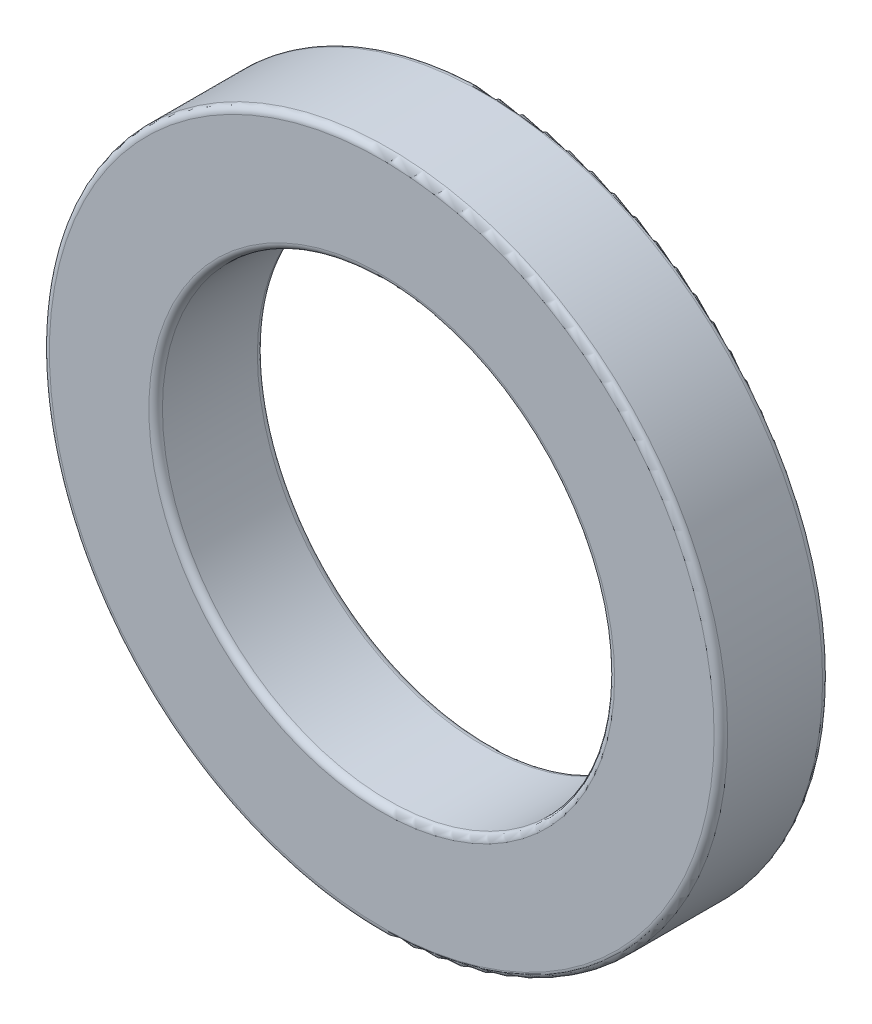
SolidWorks part; units mm, degrees
ref_plane "Face" through (0, 0, 0) normal (0, 0, 1) x (1, 0, 0)
ref_plane "Dessus" through (0, 0, 0) normal (0, 1, 0) x (1, 0, 0)
ref_plane "Droite" through (0, 0, 0) normal (1, 0, 0) x (0, 0, -1)
sketch "E_corps" plane through (0, 0, 0) normal (1, 0, 0) x (0, 0, -1)
  line L0 (-33.1757, 0) -> (55.1783, 0) construction
  line L1 (1.5, 75) -> (22.5, 75)
  line L2 (24, 73.5) -> (24, 51.5)
  line L3 (22.5, 50) -> (1.5, 50)
  line L4 (0, 51.5) -> (0, 73.5)
  line L5 (0, 50) -> (0, -50) construction
  arc A0 (0, 73.5) -> (1.5, 75) centre (1.5, 73.5) cw
  arc A1 (24, 73.5) -> (22.5, 75) centre (22.5, 73.5) ccw
  arc A2 (1.5, 50) -> (0, 51.5) centre (1.5, 51.5) cw
  arc A3 (24, 51.5) -> (22.5, 50) centre (22.5, 51.5) cw
  dimension "Rayon" = 1.5
  dimension "Rayon3" = 1.5
  dimension "Rayon1" = 1.5
  dimension "Rayon2" = 1.5
  dimension "Largeur" = 24
  dimension "Diamètre_nominal" = 100
  dimension "Diamètre_extérieur" = 150
revolve "corps" add sketch "E_corps" angle 360 about L0
sketch "E_symbole" plane through (0, 0, 0) normal (1, 0, 0) x (0, 0, -1)
  line L0 (-3.4482, 62.5) -> (19.8356, 62.5) construction
  line L1 (-33.1757, 0) -> (55.1783, 0) construction
  line L2 (2.4, 62.495) -> (2.4, 62.505)
  line L3 (2.4, 62.505) -> (11.995, 62.505)
  line L4 (2.4, 62.495) -> (11.995, 62.495)
  line L5 (11.995, 62.505) -> (11.995, 68.75)
  line L6 (11.995, 62.495) -> (11.995, 56.25)
  line L7 (11.995, 68.75) -> (12.005, 68.75)
  line L8 (11.995, 56.25) -> (12.005, 56.25)
  line L9 (12, 16.6578) -> (12, 5.8829) construction
  line L10 (12.005, 62.505) -> (12.005, 68.75)
  line L11 (21.6, 62.505) -> (12.005, 62.505)
  line L12 (21.6, 62.495) -> (21.6, 62.505)
  line L13 (21.6, 62.495) -> (12.005, 62.495)
  line L14 (12.005, 62.495) -> (12.005, 56.25)
  line L15 (24, 73.5) -> (24, 51.5) construction
  line L17 (1.5, 75) -> (22.5, 75) construction
  line L18 (0, 51.5) -> (0, 73.5) construction
  line L19 (-8.3118, 0) -> (25.8663, 0) construction
  point P7 (2.4, 62.5)
  point P16 (12, 56.25)
  point P17 (12, 68.75)
  dimension "D1" = 62.5
  dimension "D2" = 2.4
  dimension "D3" = 0.01
  dimension "D4" = 0.01
  dimension "D5" = 6.25
  dimension "D6" = 12
other "Symbole" parameters "D1"=360, "D3"=0.01, "D4"=1, "D7"=0
equation "\"Rayon3@E_corps\" = \"Rayon@E_corps\""
equation "\"Rayon2@E_corps\" = \"Rayon@E_corps\""
equation "\"Rayon1@E_corps\" = \"Rayon@E_corps\""
equation "\"D1@E_symbole\" = (\"Diamètre_nominal@E_corps\"+\"Diamètre_extérieur@E_corps\")/4"
equation "\"D2@E_symbole\" = 0.1*\"Largeur@E_corps\""
equation "\"D4@E_symbole\" = \"D3@E_symbole\""
equation "\"D5@E_symbole\" =   ( ( \"Diamètre_extérieur@E_corps\" - \"Diamètre_nominal@E_corps\")/2 )  * 0.25"
equation "\"D6@E_symbole\" = 0.5*\"Largeur@E_corps\""
